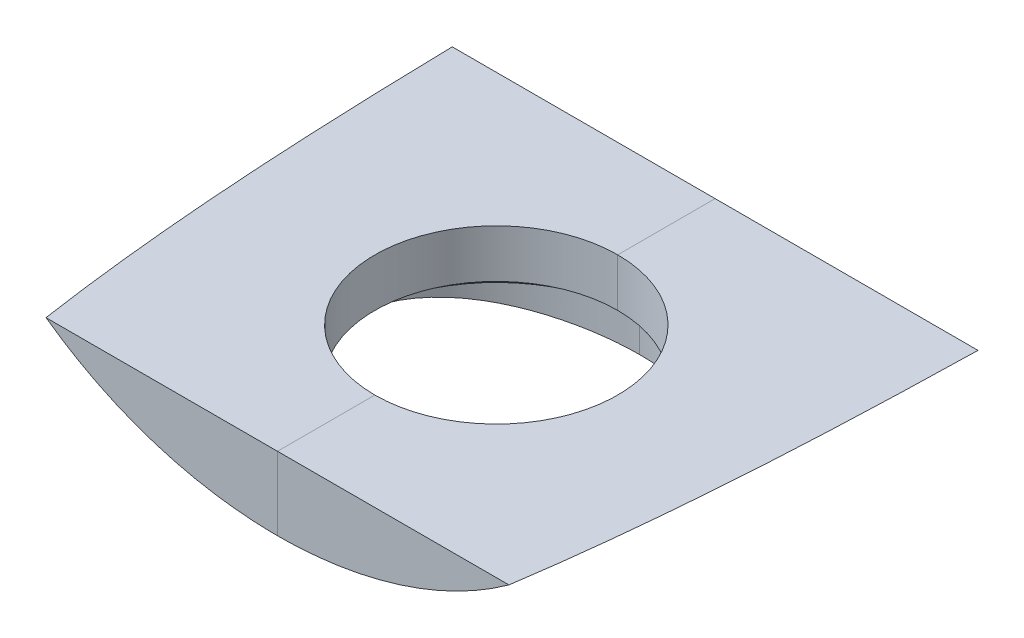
SolidWorks part; units mm, degrees
ref_plane "Front Plane" through (0, 0, 0) normal (0, 0, 1) x (1, 0, 0)
ref_plane "Top Plane" through (0, 0, 0) normal (0, 1, 0) x (1, 0, 0)
ref_plane "Right Plane" through (0, 0, 0) normal (1, 0, 0) x (0, 0, -1)
sketch "Sketch2" plane through (0, 0, 0) normal (0, 0, 1) x (1, 0, 0)
  line L2 (0, 0) -> (0, -11.5561) construction
  line L3 (30.5144, 0.0001) -> (-30.5144, -0.0001)
  spline S1 degree 3 poles (-30.5144, -0.0001) (-28.4159, -1.861) (-26.1803, -3.5016) (-22.63, -5.6456) (-21.4136, -6.3072) (-19.5389, -7.2193) (-18.9057, -7.5099) (-17.6222, -8.0636) (-16.9711, -8.3271) (-13.7053, -9.5624) (-11.0373, -10.3024) (-6.9545, -11.0502) (-5.58, -11.2387) (-3.4975, -11.4286) (-2.7988, -11.4764) (-1.3994, -11.5402) (-0.7016, -11.556) (2.7782, -11.5564) (5.5326, -11.307) (9.621, -10.5635) (10.9764, -10.2536) (12.9984, -9.693) (13.6705, -9.49) (14.9971, -9.0564) (15.6533, -8.8252) (18.9001, -7.5984) (21.3874, -6.3918) (24.9533, -4.2444) (26.1161, -3.4704) (28.3755, -1.8106) (29.4651, -0.9304) (30.5144, 0.0001) knots 0 0 0 0 0.125 0.125 0.1875 0.1875 0.21875 0.21875 0.25 0.25 0.375 0.375 0.4375 0.4375 0.46875 0.46875 0.5 0.5 0.625 0.625 0.6875 0.6875 0.71875 0.71875 0.75 0.75 0.875 0.875 0.9375 0.9375 1 1 1 1
  dimension "D2" = 11.5561
  dimension "D3" = 61.0287
ref_plane "Plane1" through (0, 0, 50.8) normal (0, 0, 1) x (1, 0, 0)
sketch "Sketch3" plane through (0, 0, 50.8) normal (0, 0, 1) x (1, 0, 0)
  line L1 (0, 0) -> (0, -8.4949) construction
  line L2 (26.8702, -0.0002) -> (-26.8702, 0.0002)
  spline S1 degree 3 poles (-26.8702, 0.0002) (-24.9169, -1.4099) (-22.8732, -2.6337) (-18.6226, -4.7445) (-16.4154, -5.631) (-13.5537, -6.5271) (-12.9751, -6.696) (-11.8167, -7.0098) (-11.236, -7.155) (-9.4899, -7.5567) (-8.3203, -7.779) (-4.7953, -8.3131) (-2.424, -8.4933) (1.1656, -8.4957) (2.3717, -8.451) (4.7585, -8.2723) (5.9425, -8.1386) (9.4669, -7.6068) (11.7798, -7.0787) (15.1923, -6.0162) (16.3202, -5.6166) (18.5559, -4.7226) (19.6505, -4.2334) (22.8655, -2.6396) (24.9172, -1.4101) (26.8702, -0.0002) knots 0 0 0 0 0.125 0.125 0.25 0.25 0.28125 0.28125 0.3125 0.3125 0.375 0.375 0.5 0.5 0.5625 0.5625 0.625 0.625 0.75 0.75 0.8125 0.8125 0.875 0.875 1 1 1 1
  dimension "D2" = 8.4949
  dimension "D3" = 53.7404
sketch "Sketch5" plane through (0, 0, 0) normal (1, 0, 0) x (0, 0, -1)
  line L0 (-117.5219, 14.189) -> (-117.5219, -11.811) construction
  line L1 (0, -11.5561) -> (0, -11.811) construction
  line L2 (-117.5219, -11.811) -> (22.4781, -11.811) construction
  line L3 (0, 0) -> (0, -11.5561) construction
  spline S0 degree 3 number of poles 202 (-50.8, -8.4949) -> (0, -11.5561)
  point P4 (0, -11.5561)
  point P9 (0, -11.5561)
  dimension "D1" = 22.4781
  dimension "D2" = 26
  dimension "D3" = 140
sketch "Sketch6" plane through (0, 0, 0) normal (1, 0, 0) x (0, 0, -1)
  line L0 (0, 0) -> (-50.8, 0)
sketch "Sketch8" plane through (0, 0, 0) normal (0, 1, 0) x (1, 0, 0)
  line L0 (-30.5141, 0) -> (-26.8699, 0) construction
  line L1 (-26.8702, -50.8) -> (26.8702, -50.8) construction
  line L2 (-26.8699, -50.8) -> (-26.8699, 0) construction
  line L3 (-30.5144, 0) -> (30.5144, 0) construction
  line L4 (0, 0) -> (0, -50.8) construction
  spline S1 degree 3 poles (-26.8699, -50.8) (-27.5053, -46.5905) (-28.0156, -42.372) (-28.8661, -33.9227) (-29.2058, -29.692) (-30.0361, -16.9862) (-30.3368, -8.4975) (-30.5141, 0) knots 0 0 0 0 0.25 0.25 0.5 0.5 1 1 1 1
  point P0 (-26.8699, -50.8)
  point P8 (30.5143, 0)
  point P14 (30.5143, 0)
  dimension "D1" = 50.8
  dimension "D2" = 3.6442
sketch "Sketch9" plane through (0, 0, 0) normal (0, 1, 0) x (1, 0, 0)
  line L0 (0, -50.8) -> (0, 0) construction
  line L1 (-26.8702, -50.8) -> (26.8702, -50.8) construction
  line L2 (26.8702, -50.8) -> (-26.8702, -50.8) construction
  line L3 (0, -50.8) -> (26.8699, -50.8) construction
  line L4 (-26.8699, -50.8) -> (0, -50.8) construction
  spline S0 degree 3 poles (-26.8699, -50.8) (-27.5053, -46.5905) (-28.0156, -42.372) (-28.8661, -33.9227) (-29.2058, -29.692) (-30.0361, -16.9862) (-30.3368, -8.4975) (-30.5141, 0) knots 0 0 0 0 0.25 0.25 0.5 0.5 1 1 1 1 only from (-26.8699, -50.8) to (-30.5143, 0) construction
  spline S2 degree 3 poles (26.8699, -50.8) (27.5053, -46.5905) (28.0157, -42.372) (28.8661, -33.9227) (29.2059, -29.692) (30.0362, -16.9862) (30.337, -8.4975) (30.5143, 0) knots 0 0 0 0 0.25 0.25 0.5 0.5 1 1 1 1
  point P16 (-26.8699, -50.8)
loft "Loft4" add profiles "Sketch2", "Sketch3"
sketch "Sketch13" plane through (0, 0, 0) normal (0, 1, 0) x (1, 0, 0)
  line L0 (0, -25.4) -> (0, 0) construction
  line L1 (0, -25.4) -> (0, -50.8) construction
  line L2 (26.8702, -50.8) -> (-26.8702, -50.8) construction
  circle A0 centre (0, -25.4) radius 16.637
  dimension "D1" = 33.274
extrude "Cut-Extrude2" cut sketch "Sketch13" against normal through all both and the other way through all
sketch "Sketch16" plane through (0, 0, 0) normal (0, 1, 0) x (1, 0, 0)
  line L0 (0, -8.255) -> (0, -11.303) construction
  line L1 (0, -11.303) -> (0, -39.497) construction
  line L2 (0, -39.497) -> (0, -42.545) construction
  circle A0 centre (0, -25.4) radius 17.145
  circle A2 centre (0, -25.4) radius 14.097
  dimension "D1" = 28.194
  dimension "D2" = 34.29
extrude "Boss-Extrude1" add sketch "Sketch16" against normal blind 5.588
ref_plane "Plane2" through (-7.62, 0, 0) normal (1, 0, 0) x (0, 0, -1)
sketch "Sketch17" plane through (-7.62, 0, 0) normal (1, 0, 0) x (0, 0, -1)
  line L0 (-5.08, -5.08) -> (-45.72, -5.08) construction
  line L1 (0, -11.5561) -> (0, 0.0001) construction
  line L2 (-50.8, 0.0002) -> (-50.8, -8.4949) construction
  line L3 (-1.905, -5.08) -> (-1.905, -13.97)
  line L4 (-1.905, -13.97) -> (-8.255, -13.97)
  line L5 (-8.255, -13.97) -> (-8.255, -5.08)
  line L6 (-42.545, -5.08) -> (-42.545, -13.97)
  line L7 (-42.545, -13.97) -> (-48.895, -13.97)
  line L8 (-48.895, -13.97) -> (-48.895, -5.08)
  line L9 (-42.545, -13.97) -> (-8.255, -13.97) construction
  arc A0 (-42.545, -5.08) -> (-48.895, -5.08) centre (-45.72, -5.08) ccw
  arc A1 (-1.905, -5.08) -> (-8.255, -5.08) centre (-5.08, -5.08) ccw
  dimension "D3" = 6.35
  dimension "D4" = 6.35
  dimension "D1" = 5.08
  dimension "D2" = 5.08
  dimension "D5" = 5.08
  dimension "D6" = 8.89
extrude "Cut-Extrude4" cut sketch "Sketch17" against normal through all
sketch "Sketch18" plane through (0, 0, 0) normal (0, 1, 0) x (1, 0, 0)
  line L0 (26.8702, -50.8) -> (-26.8702, -50.8) construction
  line L1 (30.5144, 0) -> (0, 0)
  line L2 (30.5144, 0) -> (30.5144, -50.8)
  line L3 (30.5144, -50.8) -> (0, -50.8)
  line L4 (0, 0) -> (0, -50.8)
  line L5 (30.5144, 0) -> (-30.5144, 0) construction
  spline S0 degree 3 poles (30.5144, 0) (30.2484, -12.7463) (29.5471, -29.7165) (27.5053, -46.5905) (26.8702, -50.8) knots 0 0 0 0 0.75 1 1 1 1 construction
extrude "Cut-Extrude5" cut sketch "Sketch18" against normal through all both and the other way through all contours L2 L3 L4 L1
sketch "Sketch19" plane through (0, 0, 0) normal (0, 1, 0) x (1, 0, 0)
  line L1 (0, -50.8) -> (-30.5144, -50.8)
  line L2 (0, -50.8) -> (0, 0)
  line L3 (0, 0) -> (-30.5144, 0)
  line L4 (-30.5144, -50.8) -> (-30.5144, 0)
extrude "Cut-Extrude6" cut sketch "Sketch19" along normal blind 5.08
hole_wizard "#4 Clearance Hole1" positions "Sketch21" profile "Sketch22" hole size "#4" standard "Superior"
sketch "Sketch21" plane through (-7.62, 0, 0) normal (-1, 0, 0) x (0, 0, 1)
  point P0 (5.08, -5.08)
  point P3 (45.72, -5.08)
sketch "Sketch22" plane through (-7.62, -5.08, 5.08) normal (0, 1, 0) x (0, 0, 1)
  line L0 (0, 0) -> (0, 8.6746)
  line L1 (0, 8.6746) -> (1.7272, 8.6746)
  line L2 (1.7272, 8.6746) -> (1.7272, 0)
  line L5 (1.7272, 0) -> (0, 0)
  line L11 (0, -6.35) -> (0, 107.95) construction
  dimension "Thru Hole Dia." = 3.4544
  dimension "Thru Hole Depth" = 8.6746
fillet "Fillet1" radius 1.27 8 edges at (-24.7937, -1.9091, 45.5586) (-28.0555, -1.9056, 5.0176)
chamfer "Chamfer1" distance 1.905 angle 45 1 edges at (-16.637, -5.588, 25.4)
mirror "Mirror1" about plane through (0, -11.5615, 0) normal (-1, 0, 0)
